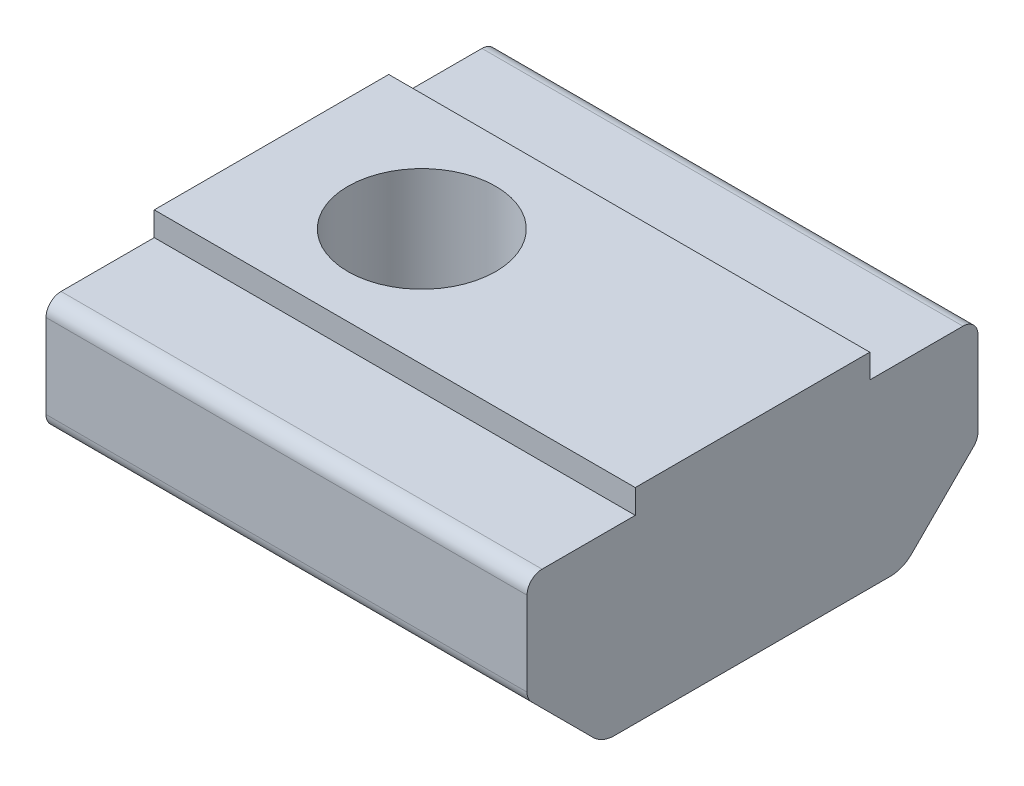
SolidWorks part; units mm, degrees
ref_plane "Front Plane" through (0, 0, 0) normal (0, 0, 1) x (1, 0, 0)
ref_plane "Top Plane" through (0, 0, 0) normal (0, 1, 0) x (1, 0, 0)
ref_plane "Right Plane" through (0, 0, 0) normal (1, 0, 0) x (0, 0, -1)
ref_plane "Plane1" through (-5, 0, 0) normal (1, 0, 0) x (0, 0, -1)
ref_plane "Plane2" through (7, 0, 0) normal (1, 0, 0) x (0, 0, -1)
sketch "Sketch1" plane through (-5, 0, 0) normal (1, 0, 0) x (0, 0, -1)
  line L0 (3.9, 0) -> (-3.9, 0)
  line L1 (-3.9, 0) -> (-3.9, -0.8)
  line L2 (-3.9, -0.8) -> (-7.5, -0.8)
  line L3 (-7.5, -0.8) -> (-7.5, -4.3)
  line L4 (-7.5, -4.3) -> (-5, -6.8)
  line L5 (-5, -6.8) -> (5, -6.8)
  line L6 (5, -6.8) -> (7.5, -4.3)
  line L7 (7.5, -4.3) -> (7.5, -0.8)
  line L8 (7.5, -0.8) -> (3.9, -0.8)
  line L9 (3.9, -0.8) -> (3.9, 0)
  line L10 (0, 0) -> (0, -6.8) construction
  point P15 (-7.5, -4.3)
  point P18 (-5, -6.8)
  point P24 (7.5, -4.3)
  dimension "FIX_8" = 10
  dimension "FIX_3" = 15
  dimension "FIX_6" = 7.8
  dimension "FIX_4" = 6.8
  dimension "FIX_5" = 6
  dimension "FIX_7" = 3.5
extrude "Boss-Extrude1" add sketch "Sketch1" along normal blind 16
fillet "Fillet1" radius 1 2 edges at (3, -6.8, 5) (3, -6.8, -5)
fillet "Fillet2" radius 0.5 4 edges at (3, -4.3, -7.5) (3, -0.8, -7.5) (3, -0.8, 7.5) (3, -4.3, 7.5)
sketch "Sketch2" plane through (7, 0, 0) normal (1, 0, 0) x (0, 0, -1)
  line L0 (0, 1.6655) -> (0, -9.505) construction
  line L2 (0, -6.6) -> (2.35, -6.6)
  line L3 (0, -6.6) -> (0, -6.8)
  line L4 (0, -6.8) -> (2.35, -6.8)
  line L5 (2.35, -6.6) -> (2.35, -6.8)
  dimension "FIX_14" = 0.2
  dimension "FIX_13" = 2.35
  dimension "FIX_12" = 6.8
revolve "Cut-Revolve1" cut sketch "Sketch2" angle 360 about L0
sketch "Sketch3" plane through (7, 0, 0) normal (1, 0, 0) x (0, 0, -1)
  line L0 (0, 0) -> (0, -7.8) construction
  line L1 (1.99, -6.6) -> (0, -6.6) construction
  line L2 (1.99, -7.8) -> (0, -7.8) construction
  line L3 (1.99, -6.6) -> (0, -6.6)
  line L4 (0, -6.6) -> (0, -7.8)
  arc A0 (0, -7.8) -> (1.99, -6.6) centre (0, -5.55) ccw
  dimension "FIX_18" = 4.5
  dimension "FIX_16" = 7.8
  dimension "FIX_17" = 6.6
revolve "Revolve1" add sketch "Sketch3" angle 360 about L0
hole_wizard "Tapped Hole1" positions "Sketch5" profile "Sketch4" tap size "M6x1.0" standard "JIS"
sketch "Sketch5" plane through (0, 0, 0) normal (0, 1, 0) x (1, 0, 0)
  point P0 (0, 0)
sketch "Sketch4" plane through (0, 0, 0) normal (1, 0, 0) x (0, 0, 1)
  line L0 (0, 0) -> (0, 7.8)
  line L1 (0, 7.8) -> (2.4585, 7.8)
  line L2 (2.4585, 7.8) -> (2.4585, 0)
  line L5 (2.4585, 0) -> (0, 0)
  line L11 (0, 0) -> (0, 7.8) construction
  dimension "Thru Tap Drill Dia." = 4.917
  dimension "Thru Tap Drill Depth" = 7.8
